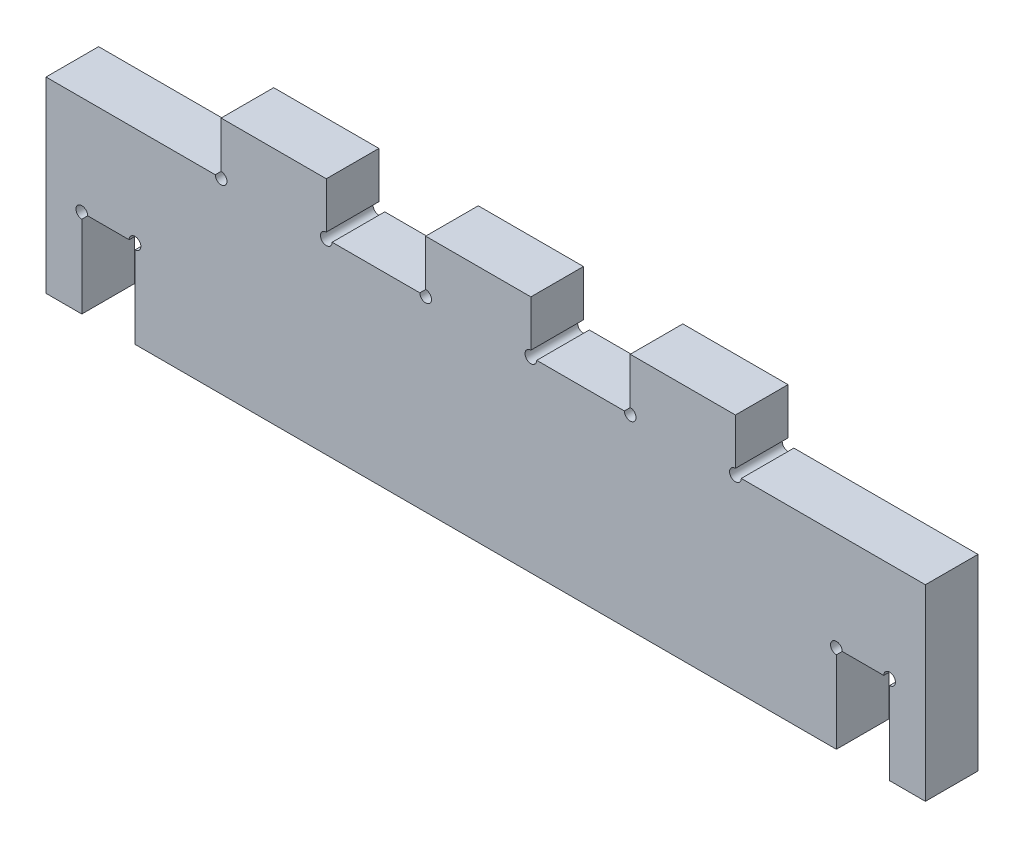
SolidWorks part; units mm, degrees
ref_plane "Front Plane" through (0, 0, 0) normal (0, 0, 1) x (1, 0, 0)
ref_plane "Top Plane" through (0, 0, 0) normal (0, 1, 0) x (1, 0, 0)
ref_plane "Right Plane" through (0, 0, 0) normal (1, 0, 0) x (0, 0, -1)
sketch "Sketch5" plane through (0, 0, -6.9921) normal (0, 0, 1) x (1, 0, 0)
  line L0 (18.6, 17.7208) -> (18.6, 47.9191)
  line L2 (18.6, 47.9191) -> (0.4, 47.9191)
  line L3 (0.4, 47.9191) -> (0.4, 17.9191)
  line L5 (0.4, 17.9191) -> (-239.6, 17.9191)
  line L6 (-239.6, 17.9191) -> (-239.6, 47.9191)
  line L8 (-239.6, 47.9191) -> (-257.8, 47.9191)
  line L10 (-257.8, 47.9191) -> (-257.8, 17.8016)
  line L11 (-257.8, 17.8016) -> (-270.0551, 17.8016)
  line L12 (-270.0551, 17.8016) -> (-270.0551, 81.9191)
  line L13 (-270.0551, 81.9191) -> (30.8551, 81.9191)
  line L15 (30.8551, 81.9191) -> (30.8551, 17.7208)
  line L16 (30.8551, 17.7208) -> (18.6, 17.7208)
  dimension "D1" = 240
  dimension "D2" = 64
  dimension "D3" = 18.2
  dimension "D4" = 30
extrude "Boss-Extrude1" add sketch "Sketch5" along normal blind 18
sketch "Sketch6" plane through (0, 81.9191, 0) normal (0, 1, 0) x (1, 0, 0)
  line L0 (30.8551, -11.0079) -> (-270.0551, -11.0079) construction
  line L1 (-70.1449, -11.0079) -> (-34.1449, -11.0079)
  line L2 (-70.1449, -11.0079) -> (-70.1449, 6.9921)
  line L3 (-70.1449, 6.9921) -> (-34.1449, 6.9921)
  line L4 (-34.1449, -11.0079) -> (-34.1449, 6.9921)
  line L5 (30.8551, 6.9921) -> (-270.0551, 6.9921) construction
  line L6 (30.8551, -11.0079) -> (30.8551, 6.9921) construction
  point P8 (-34.1449, -2.0079)
  point P11 (30.8551, -2.0079)
  dimension "D1" = 36
  dimension "D2" = 65
extrude "Boss-Extrude2" add sketch "Sketch6" along normal blind 17.8
pattern_linear "LPattern1" count 3 spacing 70 along (-1, 0, 0) of "Boss-Extrude2"
sketch "Sketch7" plane through (0, 0, 11.0079) normal (0, 0, 1) x (1, 0, 0)
  circle A0 centre (-34.1449, 81.9191) radius 2
  circle A1 centre (-70.1449, 81.9191) radius 2
  circle A2 centre (-104.1449, 81.9191) radius 2
  circle A3 centre (-140.1449, 81.9191) radius 2
  circle A4 centre (-174.1449, 81.9191) radius 2
  circle A5 centre (-210.1449, 81.9191) radius 2
  circle A6 centre (-239.6, 47.9191) radius 2
  circle A7 centre (-257.8, 47.9191) radius 2
  circle A8 centre (18.6, 47.9191) radius 2
  circle A9 centre (0.4, 47.9191) radius 2
  dimension "D1" = 4
extrude "Cut-Extrude1" cut sketch "Sketch7" against normal up to next
